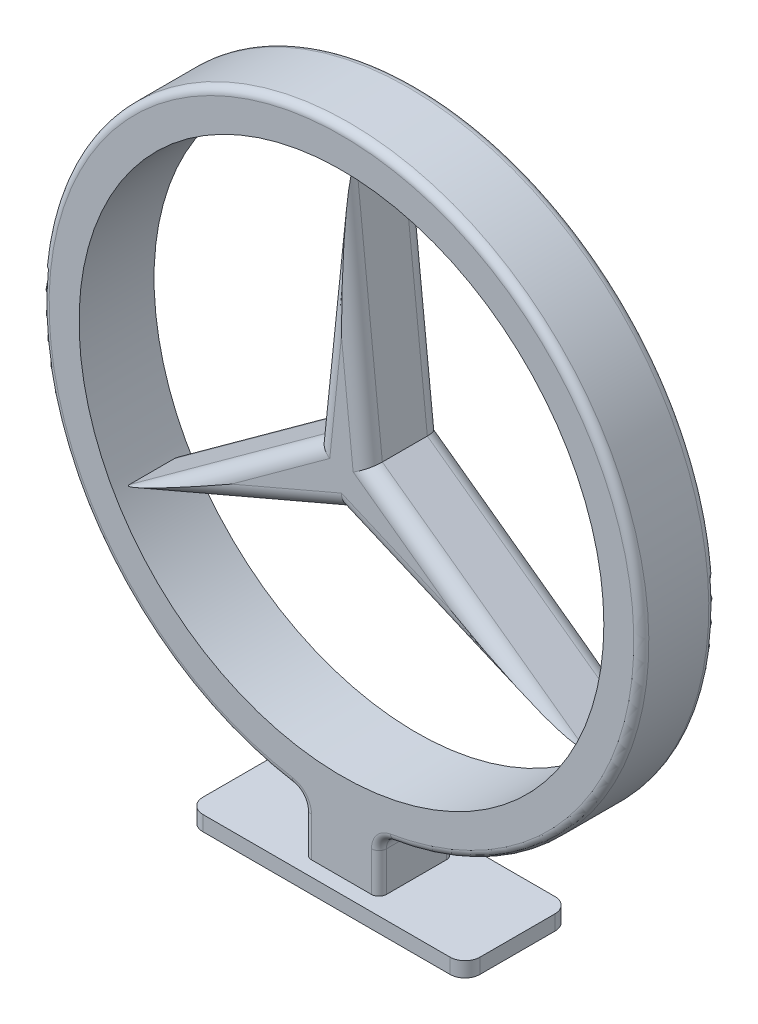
SolidWorks part; units mm, degrees
ref_plane "Ebene vorne" through (0, 0, 0) normal (0, 0, 1) x (1, 0, 0)
ref_plane "Ebene oben" through (0, 0, 0) normal (0, 1, 0) x (1, 0, 0)
ref_plane "Ebene rechts" through (0, 0, 0) normal (1, 0, 0) x (0, 0, -1)
sketch "Skizze1" plane through (0, 0, 0) normal (0, 0, 1) x (1, 0, 0)
  line L0 (0, -35) -> (0, -40) construction
  line L1 (-5, -39.6863) -> (-5, -41.6863)
  line L2 (-5, -41.6863) -> (5, -41.6863)
  line L3 (5, -41.6863) -> (5, -39.6863)
  circle A0 centre (0, 0) radius 35
  circle A1 centre (0, 0) radius 40
  dimension "D1" = 70
  dimension "D2" = 5
  dimension "D3" = 2
  dimension "D4" = 10
extrude "Aufsatz-Linear austragen1" add sketch "Skizze1" along normal blind 10
fillet "Verrundung2" radius 2 1 edges at (5, -39.6863, 5)
fillet "Verrundung3" radius 2 1 edges at (-5, -39.6863, 5)
sketch "Skizze2" plane through (0, 0, 10) normal (0, 0, 1) x (1, 0, 0)
  line L3 (0, 35) -> (0, 4.5) construction
  line L4 (-30.3109, -17.5) -> (0, -4.5)
  line L5 (0, -4.5) -> (30.3109, -17.5)
  line L6 (-30.3109, -17.5) -> (-3.4531, 1.9937)
  line L7 (3.4531, 1.9937) -> (30.3109, -17.5)
  line L8 (0, 35) -> (-3.4531, 1.9937)
  line L9 (0, 35) -> (3.4531, 1.9937)
  line L10 (0, -4.5) -> (0, -35) construction
  circle A0 centre (0, 0) radius 35 construction
extrude "Aufsatz-Linear austragen2" add sketch "Skizze2" against normal up to surface (10 mm away) separate body
fillet "Verrundung4" radius 2 12 edges at (1.7266, 18.4968, 0) (-1.7266, 18.4968, 0) (-16.882, -7.7532, 0) (-15.1554, -11, 0) (15.1554, -11, 0) (16.882, -7.7532, 0) (15.1554, -11, 10) (-15.1554, -11, 10) (-16.882, -7.7532, 10) (-1.7266, 18.4968, 10) (1.7266, 18.4968, 10) (16.882, -7.7532, 10)
sketch "Skizze3" plane through (0, -41.6863, 0) normal (0, -1, 0) x (-1, 0, 0)
  line L1 (-5, 0) -> (5, 0)
  line L2 (-5, 0) -> (-5, -10)
  line L3 (-5, -10) -> (5, -10)
  line L4 (5, 0) -> (5, -10)
  point P6 (32.797, -14.3461)
extrude "Aufsatz-Linear austragen3" add sketch "Skizze3" along normal blind 5
sketch "Skizze4" plane through (0, -46.6863, 0) normal (0, -1, 0) x (-1, 0, 0)
  line L0 (5, -5) -> (-5, -5) construction
  line L1 (16.4782, -12) -> (-16.4782, -12)
  line L2 (18.4782, -10) -> (18.4782, 0)
  line L3 (16.4782, 2) -> (-16.4782, 2)
  line L4 (-18.4782, -10) -> (-18.4782, 0)
  line L5 (5, -10) -> (5, 0) construction
  line L6 (-5, 0) -> (-5, -10) construction
  line L7 (0, -10) -> (0, 0) construction
  line L8 (-5, -10) -> (5, -10) construction
  line L9 (5, 0) -> (-5, 0) construction
  arc A0 (-16.4782, -12) -> (-18.4782, -10) centre (-16.4782, -10) cw
  arc A1 (18.4782, 0) -> (16.4782, 2) centre (16.4782, 0) ccw
  arc A2 (-16.4782, 2) -> (-18.4782, 0) centre (-16.4782, 0) ccw
  arc A3 (16.4782, -12) -> (18.4782, -10) centre (16.4782, -10) ccw
  point P20 (18.4782, 2)
  point P25 (18.4782, -12)
  dimension "D2" = 2
  dimension "D1" = 14
extrude "Aufsatz-Linear austragen4" add sketch "Skizze4" along normal blind 2
fillet "Verrundung5" radius 1 10 edges at (5, -44.0494, 0) (5, -44.0494, 10) (5.4725, -40.1216, 10) (5.4725, -40.1216, 0) (-5, -44.0494, 10) (-5, -44.0494, 0) (-5.4725, -40.1216, 10) (-5.4725, -40.1216, 0) (0, 40, 0) (0, 40, 10)
